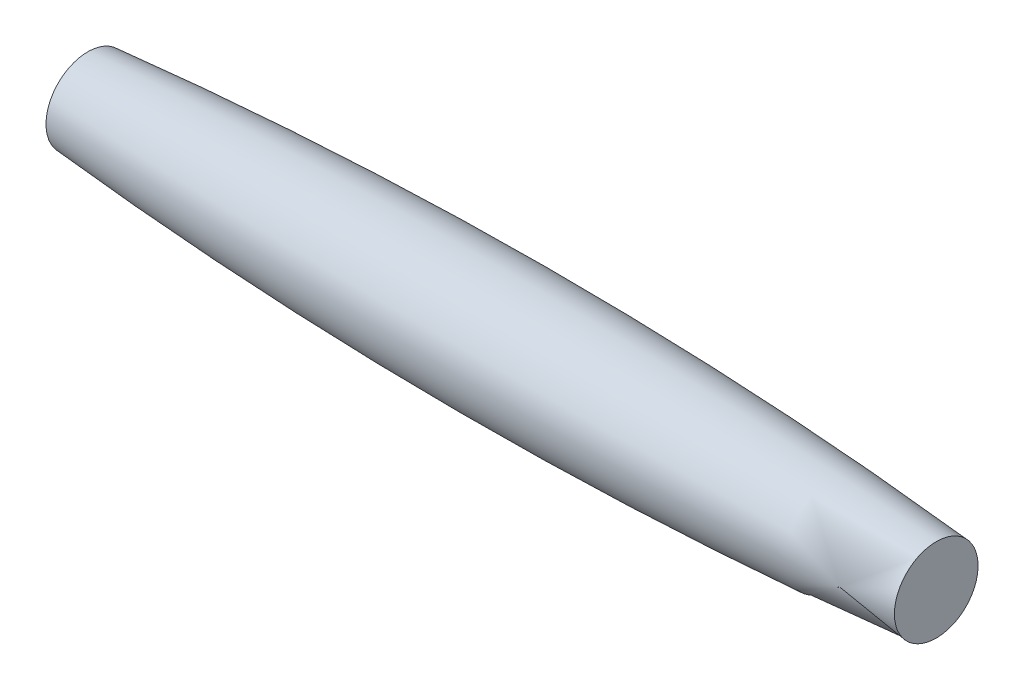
SolidWorks part; units mm, degrees
ref_plane "Ebene vorne" through (0, 0, 0) normal (0, 0, 1) x (1, 0, 0)
ref_plane "Ebene oben" through (0, 0, 0) normal (0, 1, 0) x (1, 0, 0)
ref_plane "Ebene rechts" through (0, 0, 0) normal (1, 0, 0) x (0, 0, -1)
sketch "Skizze1" plane through (0, 0, 0) normal (0, 0, 1) x (1, 0, 0)
  line L0 (-1420, 0) -> (-1420, 140)
  line L1 (1420, 0) -> (1420, 140)
  line L2 (-1495.3066, 0) -> (1497.6076, 0) construction
  line L3 (0, -23.8673) -> (0, 76.6382) construction
  line L5 (-1420, 0) -> (1420, 0)
  arc A0 (-1420, 140) -> (1420, 140) centre (0, -16633.3333) cw
  dimension "D2" = 400
  dimension "D3" = 60
  dimension "D1" = 2840
revolve "Rotation1" add sketch "Skizze1" angle 360 about L5
